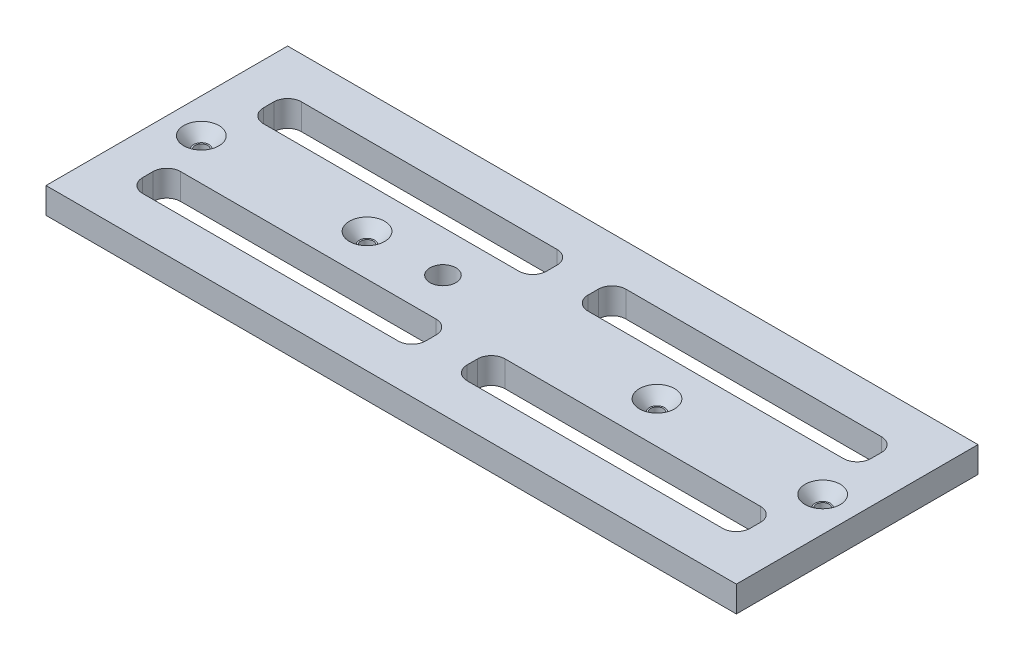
SolidWorks part; units mm, degrees
ref_plane "Front Plane" through (0, 0, 0) normal (0, 0, 1) x (1, 0, 0)
ref_plane "Top Plane" through (0, 0, 0) normal (0, 1, 0) x (1, 0, 0)
ref_plane "Right Plane" through (0, 0, 0) normal (1, 0, 0) x (0, 0, -1)
sketch "Sketch1" plane through (0, 0, 0) normal (0, 1, 0) x (1, 0, 0)
  line L1 (-63.5, -22.225) -> (63.5, -22.225)
  line L2 (-63.5, -22.225) -> (-63.5, 22.225)
  line L3 (-63.5, 22.225) -> (63.5, 22.225)
  line L4 (63.5, -22.225) -> (63.5, 22.225)
  line L5 (-63.5, -22.225) -> (63.5, 22.225) construction
  line L6 (-63.5, 22.225) -> (63.5, -22.225) construction
  point P0 (0, 0)
  dimension "D1" = 44.45
  dimension "D2" = 127
extrude "Boss-Extrude1" add sketch "Sketch1" along normal blind 4.7625
sketch "Sketch2" plane through (63.5, 0, 0) normal (1, 0, 0) x (0, 0, -1)
  line L0 (-22.225, 0) -> (22.225, 0) construction
  line L1 (3.175, 0) -> (-3.175, 0)
  arc A0 (-3.175, 0) -> (3.175, 0) centre (0, 0) cw
  dimension "D1" = 3.175
extrude "Cut-Extrude1" [suppressed] cut sketch "Sketch2" against normal through all
sketch "Sketch3" plane through (0, 4.7625, 0) normal (0, 1, 0) x (1, 0, 0)
  line L0 (-63.5, 0) -> (63.5, 0) construction
  line L1 (-63.5, 22.225) -> (-63.5, -22.225) construction
  line L2 (63.5, -22.225) -> (63.5, 22.225) construction
  line L3 (0, 22.225) -> (0, -22.225) construction
  line L4 (63.5, 22.225) -> (-63.5, 22.225) construction
  line L5 (-63.5, -22.225) -> (63.5, -22.225) construction
  circle A0 centre (-57.15, 0) radius 1.143
  circle A1 centre (-26.67, 0) radius 1.143
  circle A2 centre (26.67, 0) radius 1.143
  circle A3 centre (57.15, 0) radius 1.143
  dimension "D1" = 2.286
  dimension "D2" = 6.35
  dimension "D3" = 30.48
extrude "Cut-Extrude2" cut sketch "Sketch3" against normal through all
sketch "Sketch4" plane through (0, 4.7625, 0) normal (0, 1, 0) x (1, 0, 0)
  line L0 (0, 22.225) -> (0, -22.225) construction
  line L1 (63.5, 22.225) -> (-63.5, 22.225) construction
  line L2 (-63.5, -22.225) -> (63.5, -22.225) construction
  circle A0 centre (-57.15, 0) radius 3.2385
  circle A1 centre (-26.67, 0) radius 3.2385
  circle A2 centre (26.67, 0) radius 3.2385
  circle A3 centre (57.15, 0) radius 3.2385
  dimension "D1" = 6.477
extrude "Cut-Extrude3" cut sketch "Sketch4" against normal blind 2.1082 draft 41
sketch "Sketch5" plane through (0, 4.7625, 0) normal (0, 1, 0) x (1, 0, 0)
  circle A0 centre (-12.7, 0) radius 2.3813
  dimension "D1" = 4.7625
  dimension "D2" = 12.7
extrude "Cut-Extrude4" cut sketch "Sketch5" against normal through all
sketch "Sketch6" plane through (0, 4.7625, 0) normal (0, 1, 0) x (1, 0, 0)
  line L0 (0, 22.225) -> (0, -22.225) construction
  line L1 (63.5, 22.225) -> (-63.5, 22.225) construction
  line L2 (-63.5, -22.225) -> (63.5, -22.225) construction
  line L3 (-63.5, 0) -> (0, 0) construction
  line L4 (-63.5, 22.225) -> (-63.5, -22.225) construction
  line L5 (-3.81, -14.605) -> (-3.81, -7.62)
  line L6 (-55.88, 14.605) -> (-3.81, 14.605)
  line L7 (-55.88, 14.605) -> (-55.88, 7.62)
  line L8 (-55.88, 7.62) -> (-3.81, 7.62)
  line L9 (-3.81, 14.605) -> (-3.81, 7.62)
  line L10 (-55.88, -7.62) -> (-3.81, -7.62)
  line L11 (-55.88, -14.605) -> (-55.88, -7.62)
  line L12 (-55.88, -14.605) -> (-3.81, -14.605)
  line L13 (55.88, -14.605) -> (3.81, -14.605)
  line L14 (55.88, -14.605) -> (55.88, -7.62)
  line L15 (55.88, -7.62) -> (3.81, -7.62)
  line L16 (3.81, 14.605) -> (3.81, 7.62)
  line L17 (55.88, 7.62) -> (3.81, 7.62)
  line L18 (55.88, 14.605) -> (55.88, 7.62)
  line L19 (55.88, 14.605) -> (3.81, 14.605)
  line L20 (3.81, -14.605) -> (3.81, -7.62)
  dimension "D1" = 7.62
  dimension "D2" = 7.62
  dimension "D3" = 7.62
  dimension "D4" = 3.81
extrude "Cut-Extrude5" cut sketch "Sketch6" against normal through all
fillet "Fillet1" radius 2.54 16 edges at (55.88, 2.3813, 14.605) (55.88, 2.3813, -7.62) (55.88, 2.3813, -14.605) (55.88, 2.3813, 7.62) (3.81, 2.3813, -7.62) (3.81, 2.3813, -14.605) (3.81, 2.3813, 7.62) (3.81, 2.3813, 14.605) (-55.88, 2.3813, 14.605) (-3.81, 2.3813, 14.605) (-3.81, 2.3813, 7.62) (-55.88, 2.3813, 7.62) (-55.88, 2.3813, -7.62) (-3.81, 2.3813, -7.62) (-3.81, 2.3813, -14.605) (-55.88, 2.3813, -14.605)
